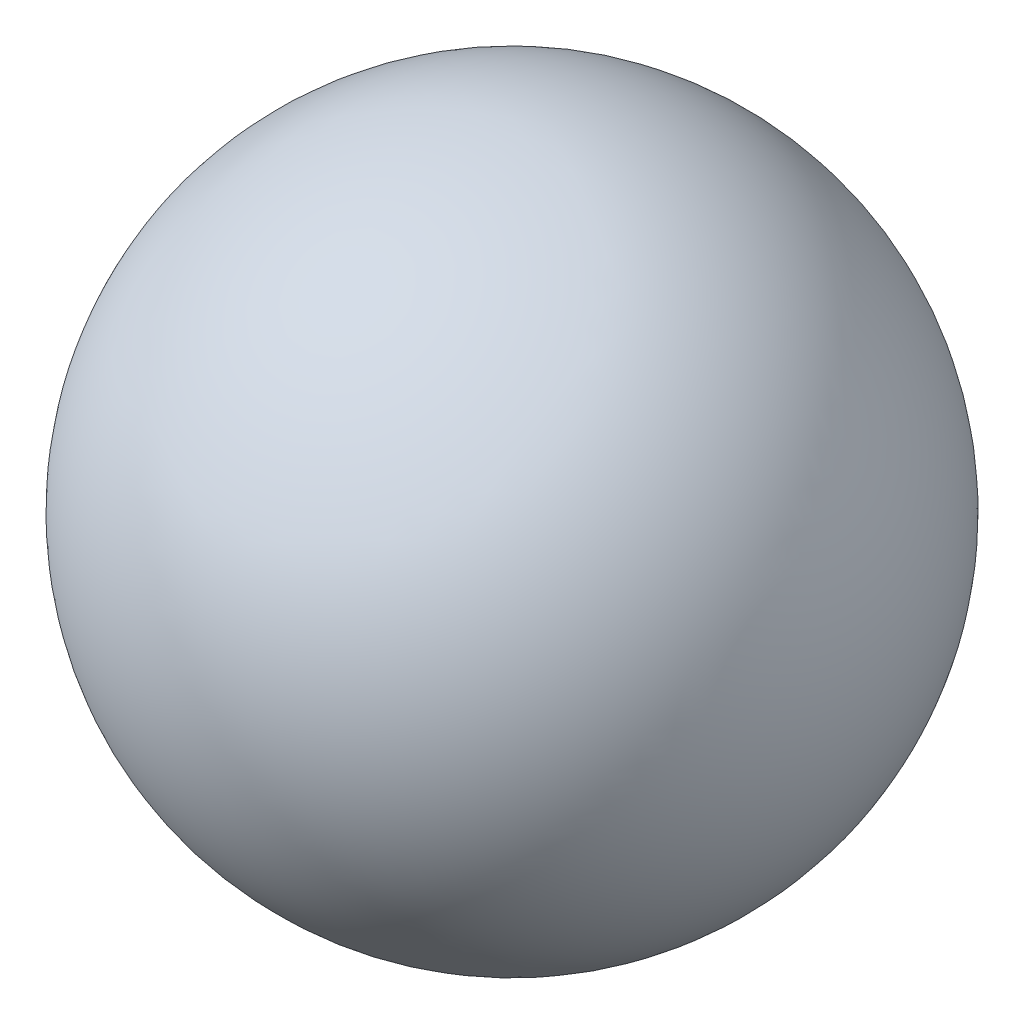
SolidWorks part; units mm, degrees
ref_plane "Plan1" through (0, 0, 0) normal (0, 0, 1) x (1, 0, 0)
ref_plane "Plan2" through (0, 0, 0) normal (0, 1, 0) x (1, 0, 0)
ref_plane "Plan3" through (0, 0, 0) normal (1, 0, 0) x (0, 0, -1)
sketch "Esquisse1" plane through (0, 0, 0) normal (0, 1, 0) x (1, 0, 0)
  line L1 (-0.6, 4.9) -> (11.4, 4.9) construction
  line L2 (-0.6, 9.8) -> (-0.6, 0) construction
  line L3 (11.4, 9.8) -> (11.4, 0) construction
  line L4 (2.1, 4.9) -> (8.7, 4.9)
  circle A1 centre (5.4, 4.9) radius 3.3 construction
  arc A2 (8.7, 4.9) -> (2.1, 4.9) centre (5.4, 4.9) ccw
revolve "Base-Révolution" add sketch "Esquisse1" angle 360 about L1
